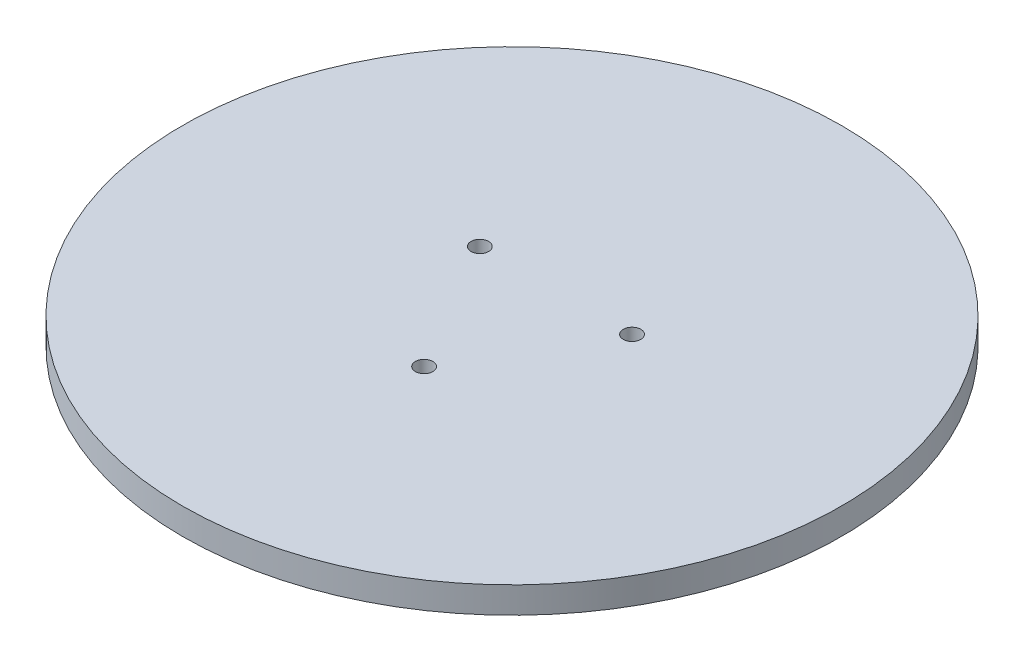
SolidWorks part; units mm, degrees
ref_plane "Front Plane" through (0, 0, 0) normal (0, 0, 1) x (1, 0, 0)
ref_plane "Top Plane" through (0, 0, 0) normal (0, 1, 0) x (1, 0, 0)
ref_plane "Right Plane" through (0, 0, 0) normal (1, 0, 0) x (0, 0, -1)
sketch "Sketch1" plane through (0, 0, 0) normal (0, 1, 0) x (1, 0, 0)
  line L1 (72.5, -72.5) -> (-72.5, -72.5) construction
  line L2 (72.5, -72.5) -> (72.5, 72.5) construction
  line L3 (72.5, 72.5) -> (-72.5, 72.5) construction
  line L4 (-72.5, -72.5) -> (-72.5, 72.5) construction
  line L5 (72.5, -72.5) -> (-72.5, 72.5) construction
  line L6 (72.5, 72.5) -> (-72.5, -72.5) construction
  circle A0 centre (0, 0) radius 75
  point P0 (0, 0)
  dimension "D2" = 150
  dimension "D1" = 145
extrude "Boss-Extrude1" add sketch "Sketch1" along normal blind 6
sketch "Sketch2" plane through (0, 0, 0) normal (0, -1, 0) x (1, 0, 0)
  line L0 (0, 0) -> (0, 20) construction
  circle A0 centre (0, 0) radius 20 construction
  circle A1 centre (0, 20) radius 2
  circle A2 centre (17.3205, -10) radius 2
  circle A3 centre (-17.3205, -10) radius 2
  point P15 (0, 0)
  dimension "D1" = 40
  dimension "D2" = 4
  dimension "D3" = 3
extrude "Cut-Extrude1" cut sketch "Sketch2" against normal up to next
